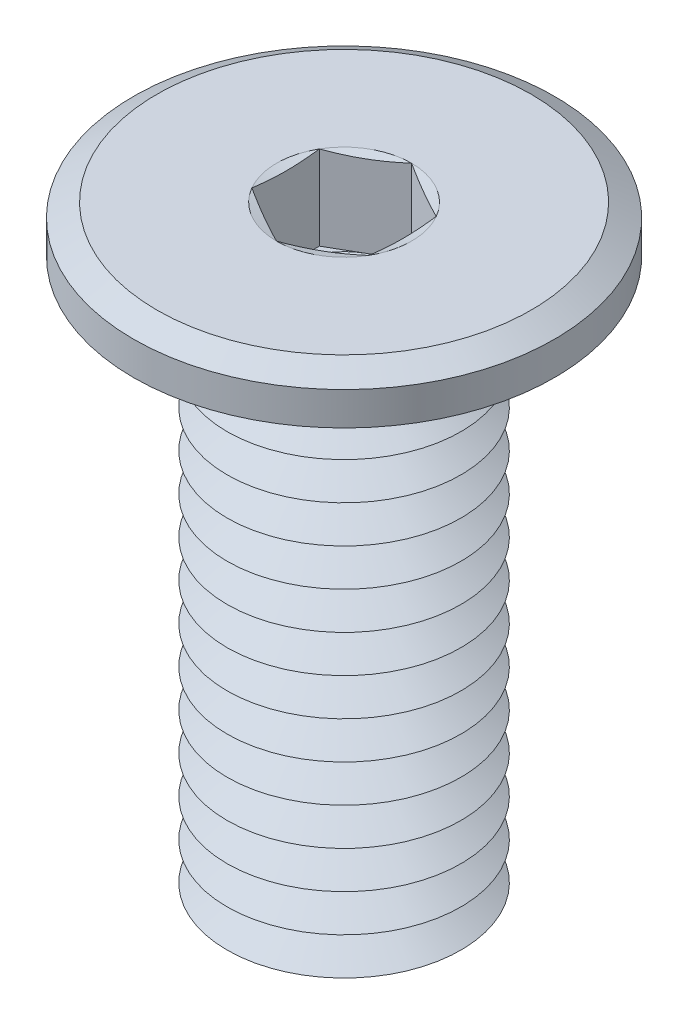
SolidWorks part; units mm, degrees
ref_plane "Front Plane" through (0, 0, 0) normal (0, 0, 1) x (1, 0, 0)
ref_plane "Top Plane" through (0, 0, 0) normal (0, 1, 0) x (1, 0, 0)
ref_plane "Right Plane" through (0, 0, 0) normal (1, 0, 0) x (0, 0, -1)
sketch "Sketch1" plane through (0, 0, 0) normal (0, 1, 0) x (1, 0, 0)
  circle A0 centre (0, 0) radius 4.5
  dimension "D1" = 9
extrude "Boss-Extrude1" add sketch "Sketch1" against normal blind 1
sketch "Sketch2" plane through (0, -1, 0) normal (0, -1, 0) x (1, 0, 0)
  circle A0 centre (0, 0) radius 2.5
  dimension "D1" = 5
extrude "Boss-Extrude2" add sketch "Sketch2" along normal blind 12
sketch "Sketch3" plane through (0, 0, 0) normal (1, 0, 0) x (0, 0, -1)
  line L0 (0, 0.9906) -> (0, -8.2999) construction
sketch "Sketch5" plane through (0, 0, 0) normal (1, 0, 0) x (0, 0, -1)
  line L0 (-2.5, -13.4) -> (-1.8072, -13)
  line L1 (-2.5, -1) -> (-2.5, -13) construction
  line L2 (-1.8072, -13) -> (-2.5, -12.6)
  line L3 (-2.5, -1) -> (-2.5, -13) construction
  line L4 (-2.5, -12.6) -> (-2.5, -13.4)
  line L6 (-2.5, -1) -> (-2.5, -13) construction
  line L7 (-2.5, -1) -> (-2.5, -13) construction
  line L14 (-2.5, -13) -> (2.5, -13) construction
  dimension "D1" = 0.8
revolve "Cut-Revolve1" cut sketch "Sketch5" angle 360 about L0
pattern_linear "LPattern1" count 14 spacing 0.8 along (0, 1, 0) of "Cut-Revolve1"
fillet "Fillet1" radius 0.2 1 edges at (0, -1, -2.5)
chamfer "Chamfer2" distance 0.5 angle 30 1 edges at (0, 0, 4.5)
sketch "Sketch6" plane through (0, 0, 0) normal (0, 1, 0) x (1, 0, 0)
  line L1 (0, 1.4434) -> (-1.25, 0.7217)
  line L2 (-1.25, 0.7217) -> (-1.25, -0.7217)
  line L3 (-1.25, -0.7217) -> (0, -1.4434)
  line L4 (0, -1.4434) -> (1.25, -0.7217)
  line L5 (1.25, -0.7217) -> (1.25, 0.7217)
  line L6 (1.25, 0.7217) -> (0, 1.4434)
  circle A0 centre (0, 0) radius 1.25 construction
  dimension "D1" = 2.5
extrude "Cut-Extrude1" cut sketch "Sketch6" against normal blind 1.8
sketch "Sketch7" plane through (0, -1.8, 0) normal (0, 1, 0) x (1, 0, 0)
  line L0 (-1.25, 0.7217) -> (-1.25, -0.7217) construction
  circle A0 centre (0, 0) radius 1.25
extrude "Cut-Extrude2" cut sketch "Sketch7" against normal through all draft 60
sketch "Sketch8" plane through (0, 0, 0) normal (0, 1, 0) x (1, 0, 0)
  circle A0 centre (0, 0) radius 1.4434
extrude "Cut-Extrude3" cut sketch "Sketch8" against normal through all draft 75
